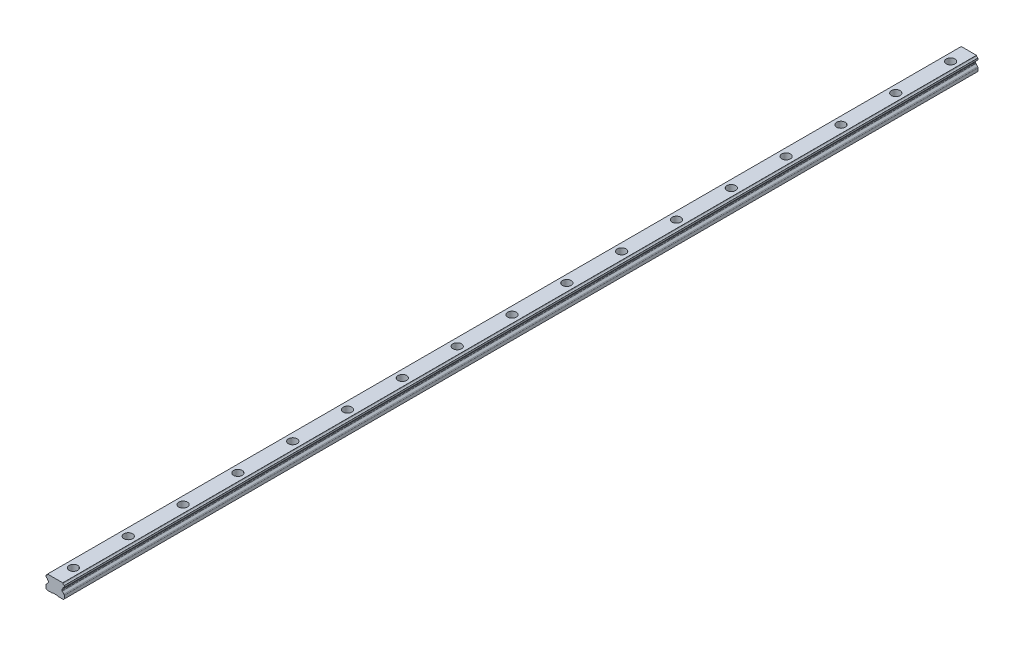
SolidWorks part; units mm, degrees
ref_plane "Front Plane" through (0, 0, 0) normal (0, 0, 1) x (1, 0, 0)
ref_plane "Top Plane" through (0, 0, 0) normal (0, 1, 0) x (1, 0, 0)
ref_plane "Right Plane" through (0, 0, 0) normal (1, 0, 0) x (0, 0, -1)
sketch "Sketch2" plane through (0, 0, 0) normal (0, 0, 1) x (1, 0, 0)
  line L0 (8.0574, 2.0607) -> (8.6541, 2.6574)
  line L1 (10.2645, 4.4551) -> (10.2645, 6.1491)
  line L2 (8.6541, 7.9467) -> (8.5987, 8.0021)
  line L3 (8.5987, 8.0021) -> (-8.0697, 8.0021)
  line L4 (-8.0697, 8.0021) -> (-8.125, 7.9467)
  line L5 (-9.7355, 6.1491) -> (-9.7355, 4.4551)
  line L6 (-8.125, 2.6574) -> (-7.5284, 2.0607)
  line L7 (-7.2355, 1.3536) -> (-7.2355, 0.4163)
  line L8 (-7.5284, -0.2908) -> (-9.2961, -2.0585)
  line L9 (-9.7355, -3.1192) -> (-9.7355, -6.4979)
  line L10 (-9.7355, -6.4979) -> (-8.7355, -7.4979)
  line L11 (-8.7355, -7.4979) -> (-2.7355, -7.4979)
  line L12 (-2.7355, -7.4979) -> (-2.2355, -6.9979)
  line L13 (-2.2355, -6.9979) -> (2.7645, -6.9979)
  line L14 (2.7645, -6.9979) -> (3.2645, -7.4979)
  line L15 (3.2645, -7.4979) -> (9.2645, -7.4979)
  line L16 (9.2645, -7.4979) -> (10.2645, -6.4979)
  line L17 (10.2645, -6.4979) -> (10.2645, -3.1192)
  line L18 (9.8252, -2.0585) -> (8.0574, -0.2908)
  line L19 (7.7645, 0.4163) -> (7.7645, 1.3536)
  arc A0 (10.2249, 4.306) -> (8.6541, 2.6574) centre (10.4017, 2.5649) ccw
  arc A1 (10.2249, 4.306) -> (10.2645, 4.4551) centre (9.9645, 4.4551) ccw
  arc A2 (10.2645, 6.1491) -> (10.2249, 6.2981) centre (9.9645, 6.1491) ccw
  arc A3 (8.6541, 7.9467) -> (10.2249, 6.2981) centre (10.4017, 8.0392) ccw
  arc A4 (-9.6958, 6.2981) -> (-8.125, 7.9467) centre (-9.8726, 8.0392) ccw
  arc A5 (-9.6958, 6.2981) -> (-9.7355, 6.1491) centre (-9.4355, 6.1491) ccw
  arc A6 (-9.7355, 4.4551) -> (-9.6958, 4.306) centre (-9.4355, 4.4551) ccw
  arc A7 (-8.125, 2.6574) -> (-9.6958, 4.306) centre (-9.8726, 2.5649) ccw
  arc A8 (-7.2355, 1.3536) -> (-7.5284, 2.0607) centre (-8.2355, 1.3536) ccw
  arc A9 (-7.5284, -0.2908) -> (-7.2355, 0.4163) centre (-8.2355, 0.4163) ccw
  arc A10 (-9.2961, -2.0585) -> (-9.7355, -3.1192) centre (-8.2355, -3.1192) ccw
  arc A11 (10.2645, -3.1192) -> (9.8252, -2.0585) centre (8.7645, -3.1192) ccw
  arc A12 (7.7645, 0.4163) -> (8.0574, -0.2908) centre (8.7645, 0.4163) ccw
  arc A13 (8.0574, 2.0607) -> (7.7645, 1.3536) centre (8.7645, 1.3536) ccw
extrude "Boss-Extrude1" add sketch "Sketch2" along normal blind 1000
sketch "Sketch3" plane through (0, 8.0021, 0) normal (0, 1, 0) x (1, 0, 0)
  line L0 (10.2645, -1000) -> (10.2645, 0) construction
  line L2 (8.5987, 0) -> (-8.0697, 0) construction
  point P0 (0.2645, -20)
  dimension "D1" = 10
  dimension "D2" = 20
hole_wizard "CBORE for M16 Hex Head Bolt1" positions "Sketch3" profile "Sketch4" counterbore size "M16" standard "DIN"
sketch "Sketch4" plane through (0.2645, 8.0021, 20) normal (1, 0, 0) x (0, 0, 1)
  line L0 (0, 0) -> (0, 15.5)
  line L1 (0, 15.5) -> (3, 15.5)
  line L3 (3, 15.5) -> (3, 8.5)
  line L4 (3, 8.5) -> (4.75, 8.5)
  line L5 (4.75, 8.5) -> (4.75, 0)
  line L7 (4.75, 0) -> (0, 0)
  line L11 (0, -6.35) -> (0, 107.95) construction
  dimension "Thru Hole Dia." = 6
  dimension "Thru Hole Depth" = 15.5
  dimension "C'Bore Dia." = 9.5
  dimension "C'Bore Depth" = 8.5
other "Fill Pattern1" parameters "D5"=0, "D6"=0, "D1"=60, "D2"=60, "D3"=0, "D9"=17, "D7"=17, "D8"=2
